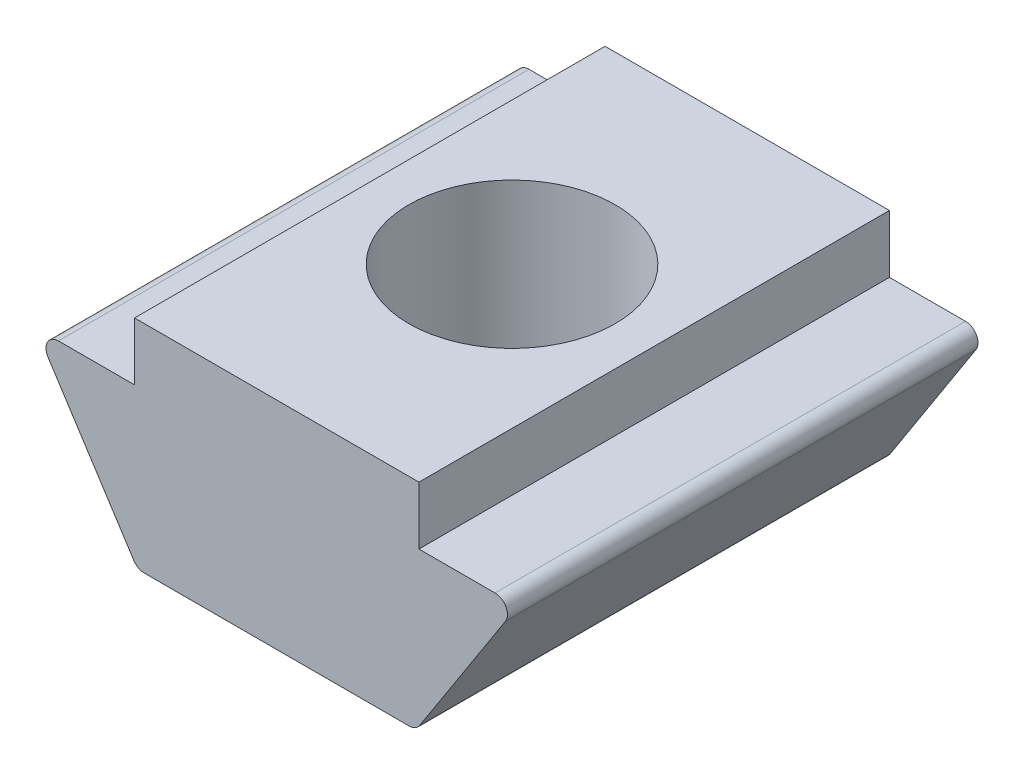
SolidWorks part; units mm, degrees
ref_plane "Front Plane" through (0, 0, 0) normal (0, 0, 1) x (1, 0, 0)
ref_plane "Top Plane" through (0, 0, 0) normal (0, 1, 0) x (1, 0, 0)
ref_plane "Right Plane" through (0, 0, 0) normal (1, 0, 0) x (0, 0, -1)
sketch "Sketch1" plane through (0, 0, 0) normal (0, 0, 1) x (1, 0, 0)
  line L0 (-2.895, 0) -> (2.895, 0)
  line L1 (2.895, 0) -> (2.895, -1.18)
  line L2 (2.895, -1.18) -> (4.91, -1.18)
  line L3 (-2.835, -4.4) -> (2.835, -4.4)
  line L4 (4.91, -1.18) -> (2.835, -4.4)
  line L5 (0, 0) -> (0, -4.4) construction
  line L6 (-4.91, -1.18) -> (-2.835, -4.4)
  line L7 (-2.895, -1.18) -> (-4.91, -1.18)
  line L8 (-2.895, 0) -> (-2.895, -1.18)
  dimension "D1" = 2.895
  dimension "D2" = 4.91
  dimension "D3" = 1.18
  dimension "D4" = 2.835
  dimension "D5" = 4.4
extrude "Boss-Extrude1" add sketch "Sketch1" along normal blind 9.58
fillet "Fillet1" radius 0.254 4 edges at (4.91, -1.18, 4.79) (-2.835, -4.4, 4.79) (2.835, -4.4, 4.79) (-4.91, -1.18, 4.79)
hole_wizard "M5x0.8 Tapped Hole1" positions "Sketch3" profile "Sketch2" tap size "M5x0.8" standard "ANSI Metric"
sketch "Sketch3" plane through (0, 0, 0) normal (0, 1, 0) x (1, 0, 0)
  point P0 (0, -4.79)
sketch "Sketch2" plane through (0, 0, 4.79) normal (1, 0, 0) x (0, 0, 1)
  line L0 (0, 0) -> (0, 15.2318)
  line L1 (0, 15.2318) -> (2.1, 13.97)
  line L2 (2.1, 13.97) -> (2.1, 0)
  line L5 (2.1, 0) -> (0, 0)
  line L10 (0, 15.2318) -> (-2.1, 13.97) construction
  line L11 (0, -6.35) -> (0, 107.95) construction
  dimension "Tap Drill Dia." = 4.2
  dimension "Tap Drill Depth" = 13.97
  dimension "Drill Angle" = 118
